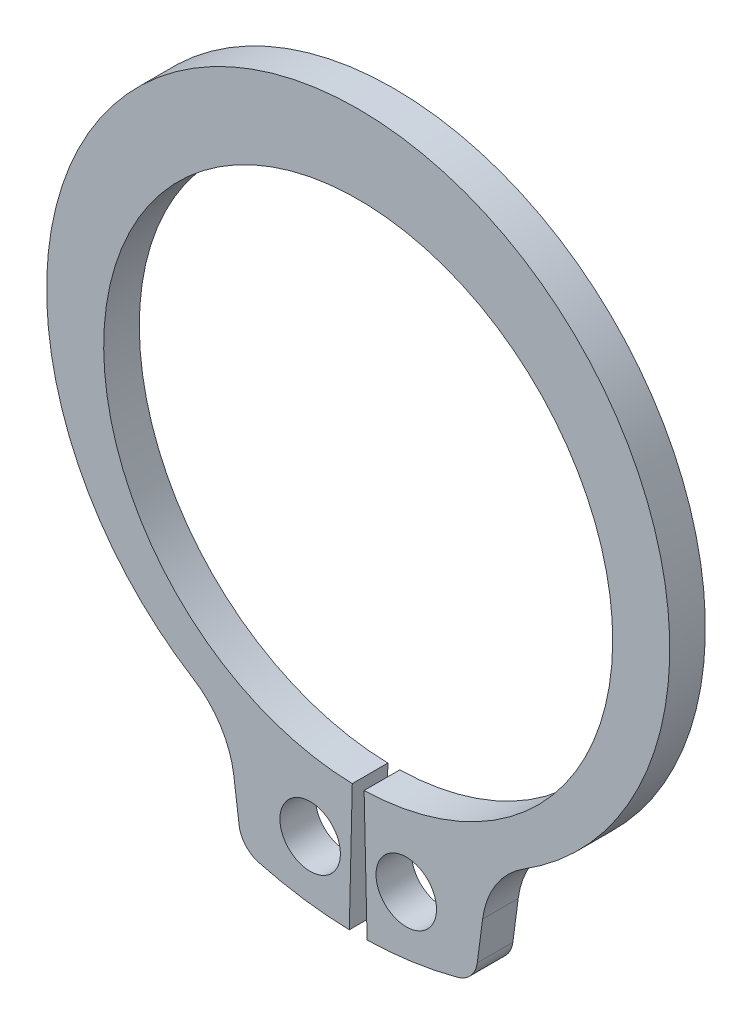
SolidWorks part; units mm, degrees
ref_plane "Plane1" through (0, 0, 0) normal (0, 0, 1) x (1, 0, 0)
ref_plane "Plane2" through (0, 0, 0) normal (0, 1, 0) x (1, 0, 0)
ref_plane "Plane3" through (0, 0, 0) normal (1, 0, 0) x (0, 0, -1)
sketch "Clipboard" plane through (0, 0, 0) normal (0, 0, 1) x (1, 0, 0)
  line L0 (0, 0) -> (2.2, 0)
  line L1 (0, 0) -> (0, 1.1)
  line L2 (0, 0) -> (0, -3.6)
  circle A0 centre (0, 0) radius 0.85
  circle A1 centre (0, 0) radius 7.5
sketch "BodySke" plane through (0, 0, 0) normal (0, 0, 1) x (1, 0, 0)
  line L0 (-1.5431, 0) -> (1.5431, 0) construction
  line L1 (0, 0) -> (0, 9.35) construction
  line L2 (0.1663, -7.1481) -> (0.25, -10.7471)
  line L3 (-0.1663, -7.1481) -> (-0.25, -10.7471)
  line L4 (0, 0) -> (5.972, -8.9385) construction
  line L5 (0, 0) -> (-5.972, -8.9385) construction
  line L7 (3.4948, -8.6124) -> (3.3446, -9.7537)
  line L8 (-3.4948, -8.6124) -> (-3.3446, -9.7537)
  circle A0 centre (0, 0) radius 7.15 construction
  arc A1 (0.1663, -7.1481) -> (-0.1663, -7.1481) centre (0, 0) ccw
  arc A2 (4.5832, -6.8598) -> (-4.5832, -6.8598) centre (0, 0.5972) ccw construction
  arc A3 (0.25, -10.7471) -> (2.7961, -10.38) centre (0, 0) ccw
  arc A4 (4.6458, -6.8209) -> (3.4948, -8.6124) centre (5.972, -8.9385) ccw
  arc A5 (-3.4948, -8.6124) -> (-4.6458, -6.8209) centre (-5.972, -8.9385) ccw
  arc A6 (-2.7961, -10.38) -> (-0.25, -10.7471) centre (0, 0) ccw
  arc A7 (4.6458, -6.8209) -> (-4.6458, -6.8209) centre (0, 0.5972) ccw
  arc A8 (-3.5203, -8.4186) -> (3.5203, -8.4186) centre (0, 0) ccw construction
  circle A9 centre (1.35, -9.0246) radius 0.85
  circle A10 centre (-1.35, -9.0246) radius 0.85
  arc A11 (3.3446, -9.7537) -> (2.7961, -10.38) centre (2.601, -9.6558) cw
  arc A12 (-3.3446, -9.7537) -> (-2.7961, -10.38) centre (-2.601, -9.6558) ccw
  point P28 (3.2809, -10.2371)
  point P31 (-3.2809, -10.2371)
extrude "Body" add sketch "BodySke" against normal blind 1
sketch "NotSke" plane through (0, 0, 0) normal (0, 0, 1) x (1, 0, 0)
  line L0 (1.35, -8.1746) -> (1.35, -9.8746)
  line L1 (1.35, -9.8746) -> (-1.35, -9.8746)
  line L2 (-1.35, -9.8746) -> (-1.35, -8.1746)
  line L3 (-1.35, -8.1746) -> (1.35, -8.1746)
  circle A0 centre (1.35, -9.0246) radius 0.85 construction
  circle A1 centre (-1.35, -9.0246) radius 0.85 construction
extrude "Notch" [suppressed] cut sketch "NotSke" against normal through all
sketch "UnlSke" plane through (0, 0, 0) normal (0, 0, 1) x (1, 0, 0)
  line L0 (-2.5738, -10.4373) -> (-1.7119, -6.942)
  line L1 (2.5738, -10.4373) -> (1.7119, -6.942)
  arc A0 (1.7119, -6.942) -> (-1.7119, -6.942) centre (0, 0) ccw
  arc A1 (2.5738, -10.4373) -> (-2.5738, -10.4373) centre (0, 0) ccw
  arc A2 (0.25, -10.7471) -> (2.7961, -10.38) centre (0, 0) ccw construction
  arc A3 (0.1663, -7.1481) -> (-0.1663, -7.1481) centre (0, 0) ccw construction
  circle A4 centre (-1.35, -9.0246) radius 0.85 construction
  circle A5 centre (1.35, -9.0246) radius 0.85 construction
extrude "Unlug" [suppressed] add sketch "UnlSke" against normal through all
equation "' \"ShaftDia@Clipboard\" = 3"
equation "' \"Thickness@Body\" = 0.4"
equation "' \"GrooveDia@BodySke\" = 2.8"
equation "' \"LugSection@Clipboard\" = 1.9"
equation "' \"LargeSection@Clipboard\" = 0.8"
equation "' \"HoleDia@Clipboard\" = 1.0"
equation "' \"ShaftDia@Clipboard\" = 10"
equation "' \"Thickness@Body\" = 1.0"
equation "' \"GrooveDia@BodySke\" = 9.6"
equation "' \"LugSection@Clipboard\" = 3.3"
equation "' \"LargeSection@Clipboard\" = 1.8"
equation "' \"HoleDia@Clipboard\" = 1.5"
equation "\"SmallSection@Clipboard\" = \"LargeSection@Clipboard\" * 0.5"
equation "\"Gap@BodySke\" =  \"Thickness@Body\" / 2"
equation "\"LargeRad@BodySke\" =  \"GrooveDia@BodySke\" / 2 +  \"LargeSection@Clipboard\""
equation "\"SmallRad@BodySke\" =  \"GrooveDia@BodySke\" / 2 +  \"SmallSection@Clipboard\""
equation "\"LugRad@BodySke\" = \"GrooveDia@BodySke\" / 2 + \"LugSection@Clipboard\""
equation "\"HoleOffsetRad@BodySke\" = (  \"ShaftDia@Clipboard\" / 2 + \"LugRad@BodySke\" ) / 2"
equation "\"HoleSpacing@BodySke\" = \"Gap@BodySke\"  * 2 +  \"HoleDia@Clipboard\""
equation "\"HoleDia@BodySke\" =  \"HoleDia@Clipboard\""
equation "\"SmallAngle@BodySke\" = atn(\"HoleSpacing@BodySke\" / 2 / sqr(\"HoleOffsetRad@BodySke\"  * \"HoleOffsetRad@BodySke\" - (\"HoleSpacing@BodySke\" / 2) * (\"HoleSpacing@BodySke\" / 2) ))  * 7 *  (\"LargeRad@BodySke\""
